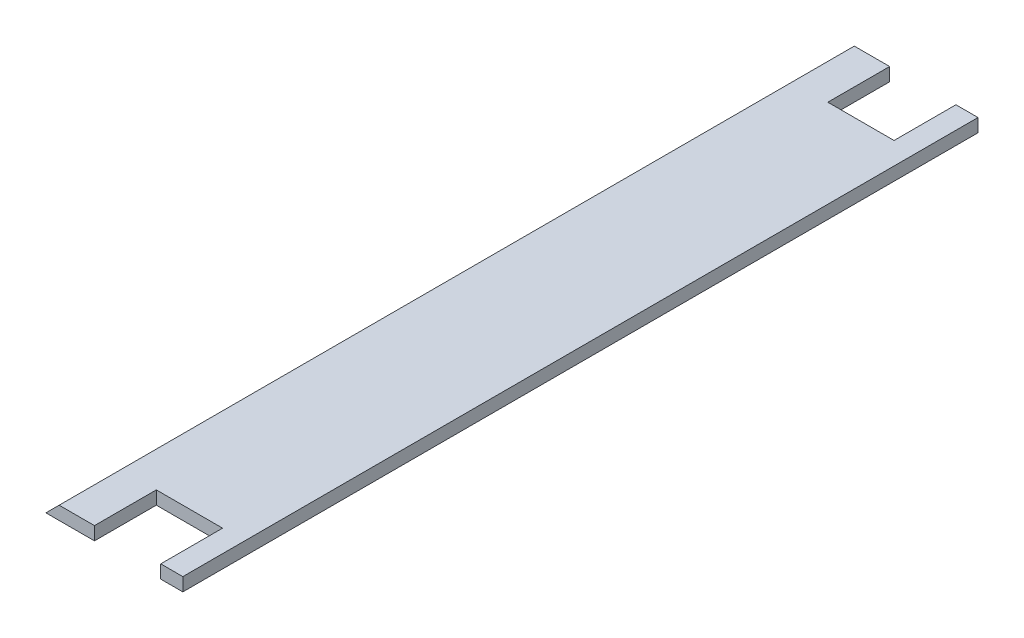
SolidWorks part; units mm, degrees
ref_plane "Face" through (0, 0, 0) normal (0, 0, 1) x (1, 0, 0)
ref_plane "Dessus" through (0, 0, 0) normal (0, 1, 0) x (1, 0, 0)
ref_plane "Droite" through (0, 0, 0) normal (1, 0, 0) x (0, 0, -1)
sketch "Esquisse1" plane through (0, 0, 0) normal (0, 0, 1) x (1, 0, 0)
  line L1 (0, 0) -> (15.5, 0)
  line L2 (0, 0) -> (0, 1.5)
  line L3 (0, 1.5) -> (15.5, 1.5)
  line L4 (15.5, 0) -> (15.5, 1.5)
  dimension "D1" = 15.5
  dimension "D2" = 1.5
extrude "Extrusion1" add sketch "Esquisse1" along normal mid plane 90
sketch "Esquisse2" plane through (0, 1.5, 0) normal (0, 1, 0) x (-1, 0, 0)
  line L0 (-15.5, -45) -> (0, -45) construction
  line L1 (-5.5, -45) -> (-13, -45)
  line L2 (-5.5, -45) -> (-5.5, -38)
  line L3 (-5.5, -38) -> (-13, -38)
  line L4 (-13, -45) -> (-13, -38)
  line L5 (-15.5, 45) -> (-15.5, -45) construction
  line L6 (-15.5, 45) -> (0, 45) construction
  line L7 (-5.5, 45) -> (-13, 45)
  line L8 (-5.5, 45) -> (-5.5, 38)
  line L9 (-5.5, 38) -> (-13, 38)
  line L10 (-13, 45) -> (-13, 38)
  dimension "D1" = 7.5
  dimension "D2" = 2.5
  dimension "D3" = 7.5
  dimension "D4" = 2.5
  dimension "D5" = 7
  dimension "D6" = 76
extrude "Enlèv. mat.-Extru.1" cut sketch "Esquisse2" against normal through all
chamfer "Chanfrein1" distance 1.5 angle 45 1 edges at (0, 1.5, 0)
fillet "Congé1" radius 0.01 1 edges at (0, 0, 0)
